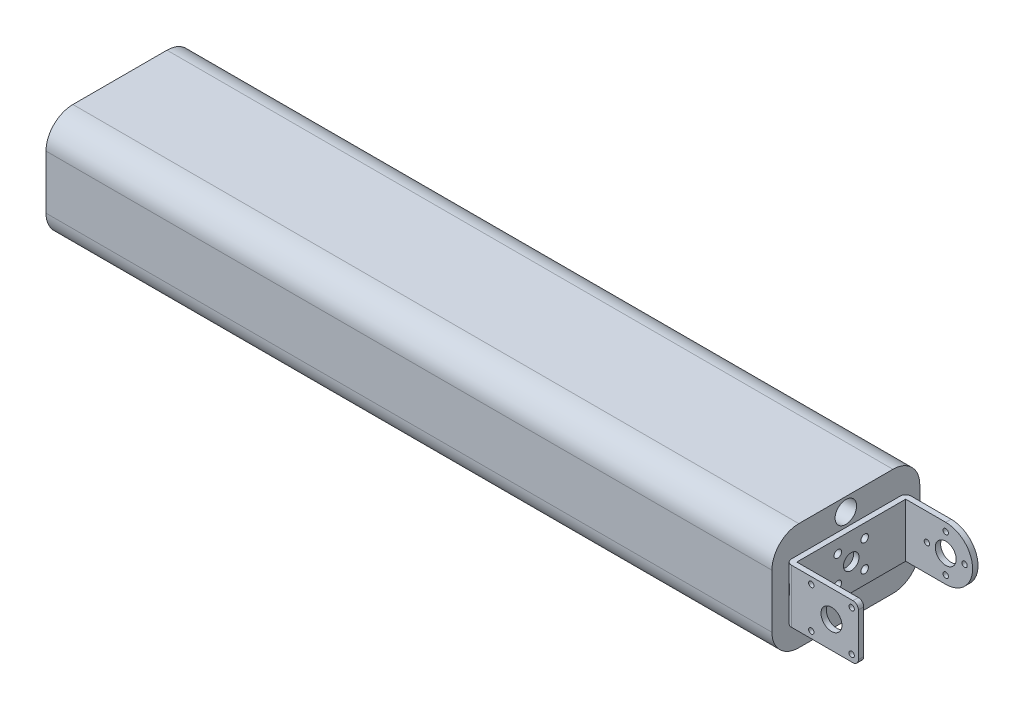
SolidWorks part; units mm, degrees
ref_plane "Front Plane" through (0, 0, 0) normal (0, 0, 1) x (1, 0, 0)
ref_plane "Top Plane" through (0, 0, 0) normal (0, 1, 0) x (1, 0, 0)
ref_plane "Right Plane" through (0, 0, 0) normal (1, 0, 0) x (0, 0, -1)
imported_body "RDS3225 v7.step-1/RDS3225.step-1/Support_small.step-1-solid1"
sketch "Sketch1" plane through (-26.9, 0, 0) normal (-1, 0, 0) x (0, 0, 1)
  line L1 (-27.5, -10) -> (27.5, -10)
  line L2 (-27.5, -10) -> (-27.5, 30)
  line L3 (-27.5, 30) -> (27.5, 30)
  line L4 (27.5, -10) -> (27.5, 30)
  line L5 (-27.5, -10) -> (27.5, 30) construction
  line L6 (-27.5, 30) -> (27.5, -10) construction
  point P0 (0, 10)
  point P1 (0, 10)
  dimension "D1" = 55
  dimension "D2" = 40
extrude "Boss-Extrude2" add sketch "Sketch1" along normal blind 270
sketch "Sketch3" plane through (-26.9, 0, 0) normal (1, 0, 0) x (0, 0, -1)
  line L0 (0, 20) -> (0, 30) construction
  line L1 (-5, 22.5) -> (5, 22.5)
  line L2 (-5, 22.5) -> (-5, 27.5)
  line L3 (-5, 27.5) -> (5, 27.5)
  line L4 (5, 22.5) -> (5, 27.5)
  line L5 (-5, 22.5) -> (5, 27.5) construction
  line L6 (-5, 27.5) -> (5, 22.5) construction
  line L7 (-20.25, 20) -> (20.25, 20) construction
  line L8 (-27.5, 30) -> (27.5, 30) construction
  point P0 (0, 10)
  point P1 (0, 25)
  point P15 (0, 25)
  dimension "D1" = 10
  dimension "D2" = 5
ref_point "Point2"
ref_point "Point1"
sketch "Sketch5" plane through (-296.9, 0, 0) normal (-1, 0, 0) x (0, 0, 1)
  line L1 (-5, 6.5) -> (5, 6.5) construction
  line L2 (-5, 6.5) -> (-5, 13.5) construction
  line L3 (-5, 13.5) -> (5, 13.5) construction
  line L4 (5, 6.5) -> (5, 13.5) construction
  line L5 (-5, 6.5) -> (5, 13.5) construction
  line L6 (-5, 13.5) -> (5, 6.5) construction
  circle A0 centre (0, 10) radius 4
  point P0 (0, 10)
  dimension "D3" = 8
  dimension "D1" = 10
  dimension "D2" = 7
sketch "Sketch7" plane through (0, 0, 27.5) normal (0, 0, 1) x (1, 0, 0)
  line L0 (-296.9, 10) -> (-26.9, 25)
sweep "Cut-Sweep2" cut profiles "Sketch5" path "Sketch7"
fillet "Fillet1" radius 10 4 edges at (-161.9, -10, -27.5) (-161.9, 30, -27.5) (-161.9, -10, 27.5) (-161.9, 30, 27.5)
sketch "Sketch9" plane through (-26.9, 0, 0) normal (1, 0, 0) x (0, 0, -1)
  circle A0 centre (-5, 15) radius 1.4
  circle A1 centre (5, 15) radius 1.4
  circle A2 centre (-5, 5) radius 1.4
  circle A3 centre (5, 5) radius 1.4
extrude "Cut-Extrude1" cut sketch "Sketch9" against normal blind 4
